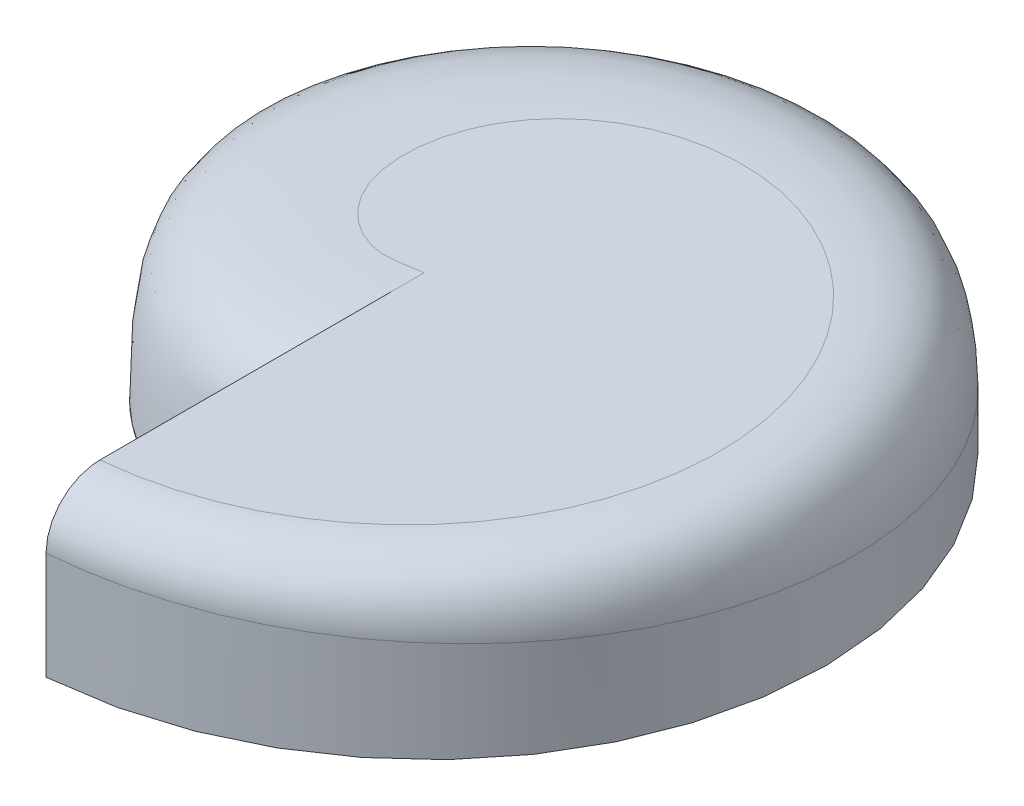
SolidWorks part; units mm, degrees
ref_plane "Front Plane" through (0, 0, 0) normal (0, 0, 1) x (1, 0, 0)
ref_plane "Top Plane" through (0, 0, 0) normal (0, 1, 0) x (1, 0, 0)
ref_plane "Right Plane" through (0, 0, 0) normal (1, 0, 0) x (0, 0, -1)
sketch "Sketch1" plane through (0, 0, 0) normal (0, 1, 0) x (1, 0, 0)
  circle A0 centre (0, 0) radius 40.45
  dimension "D1" = 80.9
curve "Helix/Spiral1"
sketch "Sketch3" plane through (0, 0, 0) normal (0, 1, 0) x (1, 0, 0)
  line L0 (0, -40.45) -> (0, -80.45)
  spline S0 degree 3 number of poles 66 (0, -40.45) -> (0, -80.45) construction
  spline S1 degree 3 number of poles 66 (0, -40.45) -> (0, -80.45)
extrude "Boss-Extrude1" add sketch "Sketch3" along normal blind 30
fillet "VarFillet1" radius 10 1 edges
